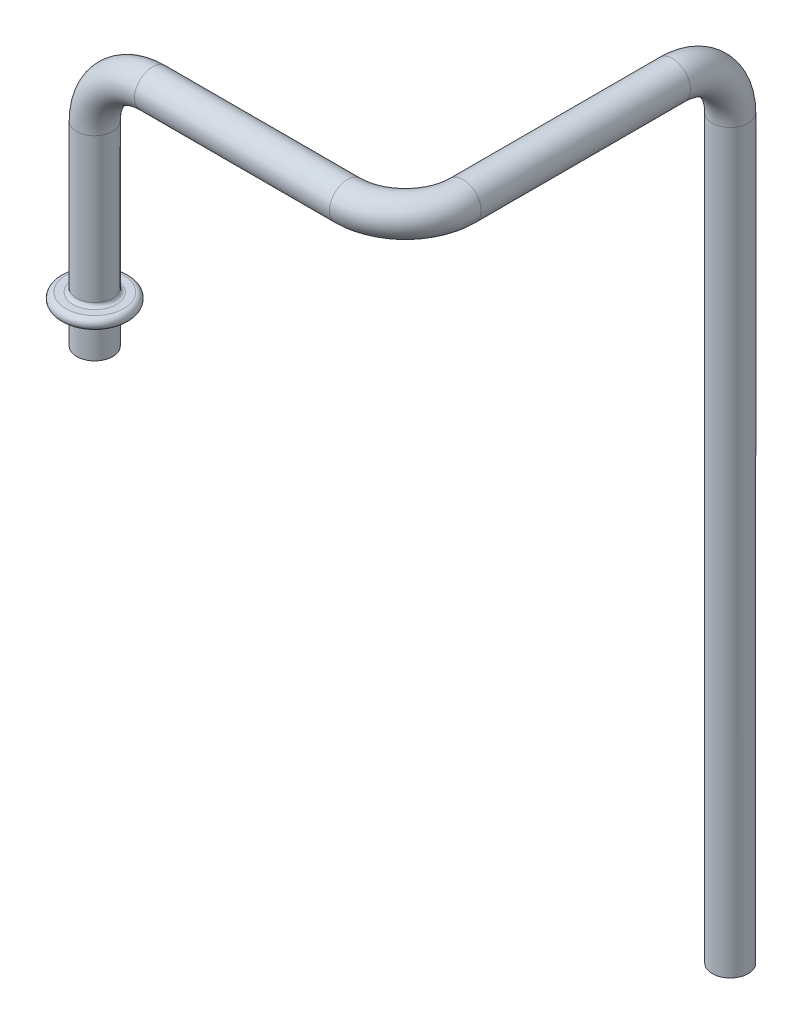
SolidWorks part; units mm, degrees
ref_plane "Front" through (0, 0, 0) normal (0, 0, 1) x (1, 0, 0)
ref_plane "Top" through (0, 0, 0) normal (0, 1, 0) x (1, 0, 0)
ref_plane "Right" through (0, 0, 0) normal (1, 0, 0) x (0, 0, -1)
sketch3d "3DSketch1"
  line L0 (0, 0, 0) -> (0, 27, 0)
  line L1 (8, 35, 0) -> (35, 35, 0)
  line L2 (43, 35, -8) -> (43, 35, -37)
  line L3 (43, 27, -45) -> (43, -75, -45)
  arc A0 (43, 35, -37) -> (43, 27, -45) centre (43, 27, -37) ccw
  arc A1 (35, 35, 0) -> (43, 35, -8) centre (35, 35, -8) ccw
  arc A2 (0, 27, 0) -> (8, 35, 0) centre (8, 27, 0) ccw
  point P8 (43, 35, -45)
  point P9 (35, 27, -37)
  point P12 (43, 35, 0)
  point P13 (35, 43, -8)
  point P16 (0, 35, 0)
  point P17 (8, 27, -8)
  dimension "D1" = 8
  dimension "D2" = 35
  dimension "D3" = 43
  dimension "D4" = 45
  dimension "D5" = 110
sketch "Sketch2" plane through (0, 0, 0) normal (0, 1, 0) x (1, 0, 0)
  circle A0 centre (0, 0) radius 2.5
  dimension "D1" = 5
sweep "Sweep-Thin1" add profiles "Sketch2" path "3DSketch1" parameters "D1"=0.5
sketch "Sketch3" plane through (0, 0, 0) normal (1, 0, 0) x (0, 0, -1)
  line L0 (-2.5, 5) -> (-4, 5)
  line L1 (-2.5, 27) -> (-2.5, 0) construction
  line L2 (-4, 6.5) -> (-2.5, 6.5)
  line L3 (-2.5, 27) -> (-2.5, 0) construction
  line L4 (-2.5, 6.5) -> (-2.5, 5)
  line L5 (0, 0) -> (0, 2.629) construction
  arc A0 (-4, 5) -> (-4, 6.5) centre (-4, 5.75) cw
  dimension "D1" = 1.5
  dimension "D2" = 5
  dimension "D3" = 1.5
revolve "Revolve1" add sketch "Sketch3" angle 360 about L5
fillet "Fillet1" radius 0.5 2 edges at (0, 5, 2.5) (0, 6.5, -2.5)
